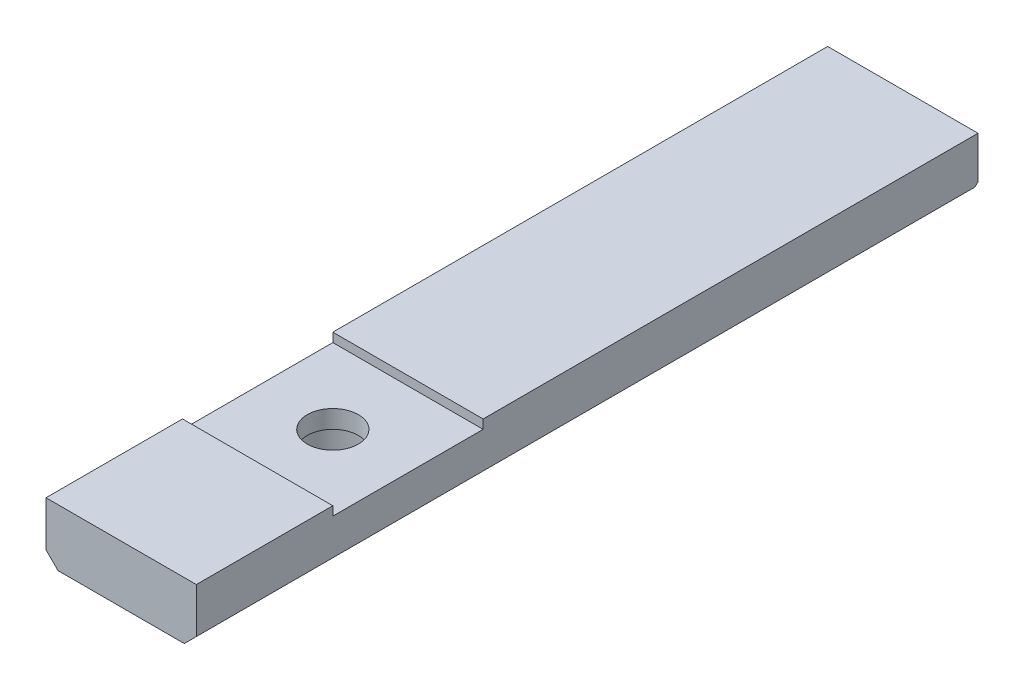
SolidWorks part; units mm, degrees
ref_plane "Plan1" through (0, 0, 0) normal (0, 0, 1) x (1, 0, 0)
ref_plane "Plan2" through (0, 0, 0) normal (0, 1, 0) x (1, 0, 0)
ref_plane "Plan3" through (0, 0, 0) normal (1, 0, 0) x (0, 0, -1)
sketch "Esquisse1" plane through (0, 0, 0) normal (0, 0, 1) x (1, 0, 0)
  line L0 (-12.5, 0) -> (-6.1, 0)
  line L1 (-6.1, 0) -> (-6.1, 1.5)
  line L2 (-6.1, 1.5) -> (6.1, 1.5)
  line L3 (6.1, 1.5) -> (6.1, 0)
  line L4 (6.1, 0) -> (12.5, 0)
  line L5 (-12.5, 0) -> (-12.5, 11.5)
  line L6 (-12.5, 11.5) -> (12.5, 11.5)
  line L7 (12.5, 11.5) -> (12.5, 0)
  line L8 (0, 21.0228) -> (0, -6.5728) construction
  dimension "D1" = 12.2
  dimension "D4" = 25
  dimension "D5" = 1.5
  dimension "D6" = 11.5
extrude "Base-Extrusion" add sketch "Esquisse1" along normal blind 130
chamfer "Chanfrein1" distance 0.5 angle 45 2 edges at (-6.1, 0, 65) (6.1, 0, 65)
sketch "Esquisse2" plane through (12.5, 0, 0) normal (1, 0, 0) x (0, 0, -1)
  line L0 (-130, 2) -> (-128, 0)
  line L1 (0, 4.5) -> (-4.5, 0)
  line L2 (-130, 0) -> (0, 0) construction
  line L3 (-130, 0) -> (-128, 0)
  line L4 (0, 0) -> (0, 11.5) construction
  line L5 (0, 0) -> (0, 4.5)
  line L6 (-130, 0) -> (-130, 11.5) construction
  line L7 (-130, 0) -> (-130, 2)
  line L8 (-4.5, 0) -> (0, 0)
  line L9 (-130, 11.5) -> (0, 11.5) construction
  line L10 (-107.3, 11.5) -> (-82.3, 11.5)
  line L11 (-107.3, 11.5) -> (-107.3, 10)
  line L12 (-107.3, 10) -> (-82.3, 10)
  line L13 (-82.3, 10) -> (-82.3, 11.5)
  line L14 (-94.8, 21.0588) -> (-94.8, 4.5) construction
  dimension "D1" = 4.5
  dimension "D2" = 2
  dimension "D3" = 2
  dimension "D4" = 25
  dimension "D5" = 1.5
  dimension "D6" = 35.2
extrude "Enlèv. mat.-Extru.1" cut sketch "Esquisse2" against normal through all
sketch "Esquisse5" plane through (0, 10, 0) normal (0, 1, 0) x (-1, 0, 0)
  line L0 (12.5, 107.3) -> (-12.5, 82.3) construction
  line L1 (-12.5, 130) -> (12.5, 130) construction
  line L2 (0, 130) -> (0, 58.7426) construction
  circle A0 centre (0, 94.8) radius 4.25
  dimension "D1" = 8.5
extrude "Enlèv. mat.-Extru.2" cut sketch "Esquisse5" against normal through all
sketch "Esquisse6" plane through (0, 1.5, 0) normal (0, -1, 0) x (1, 0, 0)
  circle A0 centre (0, 94.8) radius 7
  circle A1 centre (0, 94.8) radius 4.25 construction
  dimension "D1" = 14
extrude "Enlèv. mat.-Extru.3" cut sketch "Esquisse6" against normal blind 5.5 and the other way blind 140
chamfer "Chanfrein2" distance 4 angle 45 2 edges at (12.5, 0, 66.25) (-12.5, 0, 66.25)
